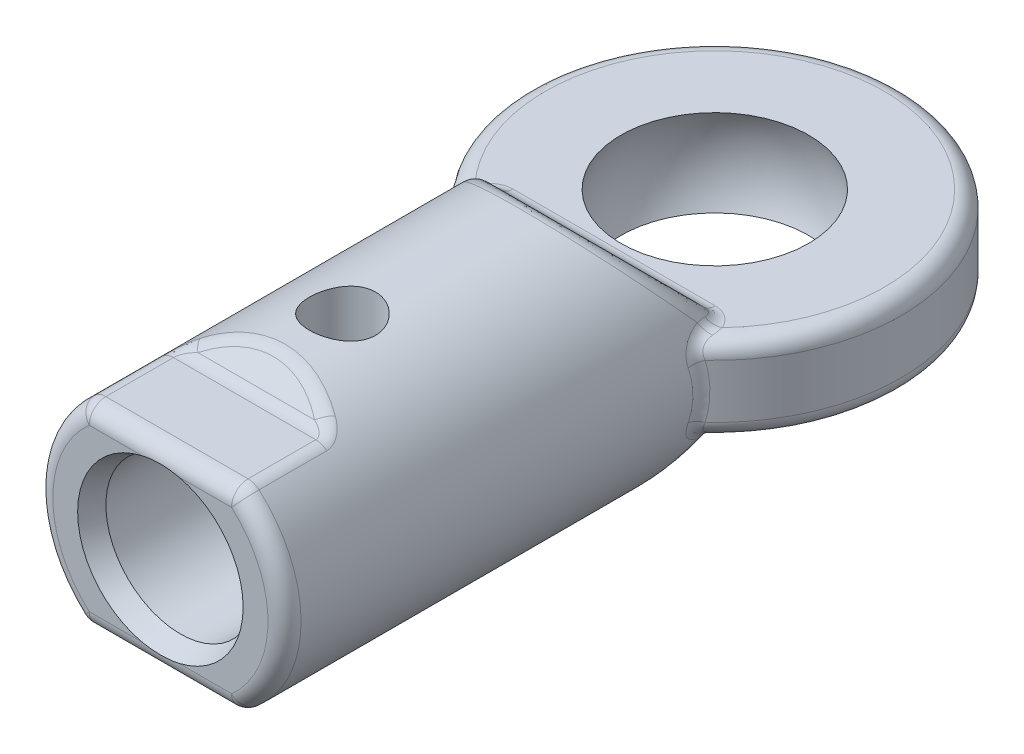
SolidWorks part; units mm, degrees
ref_plane "Face" through (0, 0, 0) normal (0, 0, 1) x (1, 0, 0)
ref_plane "Dessus" through (0, 0, 0) normal (0, 1, 0) x (1, 0, 0)
ref_plane "Droite" through (0, 0, 0) normal (1, 0, 0) x (0, 0, -1)
ref_plane "Plan1" through (0, 0, 67) normal (0, 0, 1) x (1, 0, 0)
sketch "Esquisse2" plane through (0, 0, 67) normal (0, 0, 1) x (1, 0, 0)
  circle A0 centre (0, 0) radius 15
  dimension "D1" = 30
sketch "Esquisse1" plane through (0, 0, 0) normal (0, 0, 1) x (1, 0, 0)
  line L0 (22.5, 3.25) -> (22.5, -3.25)
  line L1 (11.3441, 5.25) -> (20.5, 5.25)
  line L2 (31.7601, 0) -> (-6.1564, 0) construction
  line L3 (11.3441, -5.25) -> (20.5, -5.25)
  line L4 (0, 0) -> (0, 25.6868) construction
  arc A0 (11.3441, -5.25) -> (11.3441, 5.25) centre (0, 0) ccw
  arc A1 (20.5, 5.25) -> (22.5, 3.25) centre (20.5, 3.25) cw
  arc A2 (20.5, -5.25) -> (22.5, -3.25) centre (20.5, -3.25) ccw
  point P9 (22.5, 0)
  dimension "D1" = 25
  dimension "D4" = 2
  dimension "D2" = 5.25
  dimension "D3" = 22.5
revolve "Révolution1" add sketch "Esquisse1" angle 360 about L4
extrude "Extrusion2" add sketch "Esquisse2" against normal blind 54
sketch "Esquisse3" plane through (0, 0, 0) normal (1, 0, 0) x (0, 0, -1)
  line L0 (-13, 5.25) -> (-29.5581, 21.8081)
  line L1 (0, 0) -> (-70.0633, 0) construction
  line L2 (-29.5581, 21.8081) -> (-13, 21.8081)
  line L3 (-13, 21.8081) -> (-13, 5.25)
  line L4 (-29.5581, -21.8081) -> (-13, -21.8081)
  line L5 (-13, -21.8081) -> (-13, -5.25)
  line L6 (-13, -5.25) -> (-29.5581, -21.8081)
  line L7 (-69.8467, 11.75) -> (-56, 11.75)
  line L8 (-56, 11.75) -> (-50.2068, 17.5432)
  line L9 (-67, 15) -> (-67, -15) construction
  line L10 (-50.2068, 17.5432) -> (-69.8467, 17.5432)
  line L11 (-69.8467, 17.5432) -> (-69.8467, 11.75)
  line L12 (-69.8467, -17.5432) -> (-69.8467, -11.75)
  line L13 (-50.2068, -17.5432) -> (-69.8467, -17.5432)
  line L14 (-56, -11.75) -> (-50.2068, -17.5432)
  line L15 (-69.8467, -11.75) -> (-56, -11.75)
  dimension "D1" = 45
  dimension "D2" = 11
  dimension "D3" = 45
  dimension "D4" = 11.75
extrude "Enlèv. mat.-Extru.1" cut sketch "Esquisse3" against normal through all and the other way through all
fillet "Congé5" radius 2
fillet "Congé7" radius 2
sketch "Esquisse5" plane through (0, 0, 67) normal (0, 0, 1) x (1, 0, 0)
  point P0 (0, 0)
hole_wizard "Dégagement M1.61" positions "Esquisse11" profile "Esquisse10" hole size "M1.6" standard "Ansi Métrique"
sketch "Esquisse11" plane through (0, 0, 67) normal (0, 0, 1) x (1, 0, 0)
  point P0 (0, 0)
sketch "Esquisse10" plane through (0, 0, 67) normal (1, 0, 0) x (0, -1, 0)
  line L0 (0, 0) -> (0, 42.4077)
  line L1 (0, 42.4077) -> (9, 37)
  line L2 (9, 37) -> (9, 2.4142)
  line L3 (9, 2.4142) -> (10, 0)
  line L5 (10, 0) -> (0, 0)
  line L6 (-9, 2.4142) -> (-10, 0) construction
  line L10 (0, 42.4077) -> (-9, 37) construction
  line L11 (0, -6.35) -> (0, 107.95) construction
  dimension "Diamètre du perçage" = 18
  dimension "Profondeur du perçage" = 37
  dimension "Diamètre du fraisage entrant" = 20
  dimension "Angle du fraisage entrant" = 45
  dimension "Angle de pointe" = 118
sketch "Esquisse12" plane through (0, 0, 0) normal (0, 1, 0) x (1, 0, 0)
  line L0 (8.5987, -67) -> (2.222, -67) construction
  circle A0 centre (0, -45) radius 4
  dimension "D2" = 8
  dimension "D1" = 22
extrude "Enlèv. mat.-Extru.2" cut sketch "Esquisse12" against normal through all and the other way through all
